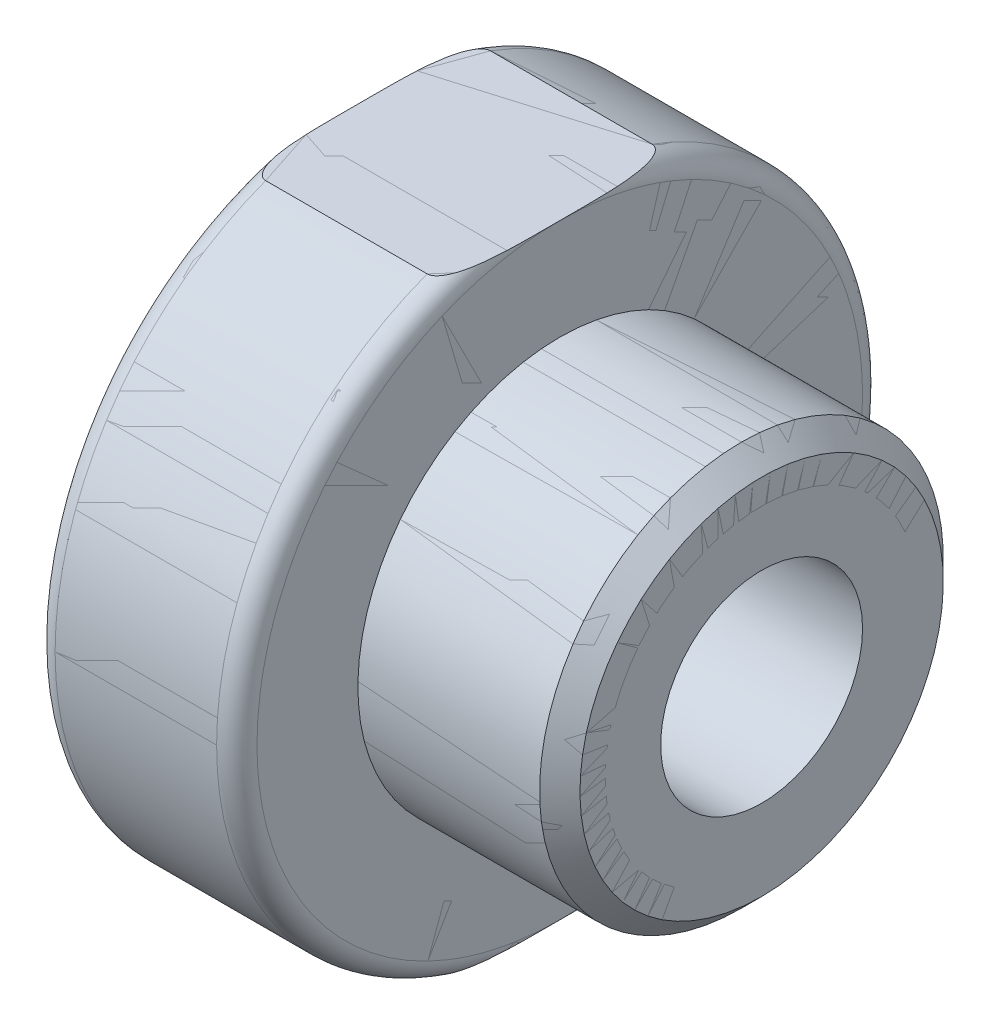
SolidWorks part; units mm, degrees
ref_plane "Plan de face" through (0, 0, 0) normal (0, 0, 1) x (1, 0, 0)
ref_plane "Plan de dessus" through (0, 0, 0) normal (0, 1, 0) x (1, 0, 0)
ref_plane "Plan de droite" through (0, 0, 0) normal (1, 0, 0) x (0, 0, -1)
imported_body "Importée1"
sketch "Esquisse1" plane through (20, 0, 0) normal (1, 0, 0) x (0, 0, -1)
  circle A0 centre (0, 0) radius 7.75 construction
  circle A1 centre (0, 0) radius 7.75
  circle A2 centre (0, 0) radius 5
  dimension "D1" = 10
extrude "Extrusion1" add sketch "Esquisse1" against normal up to surface (20 mm away)
